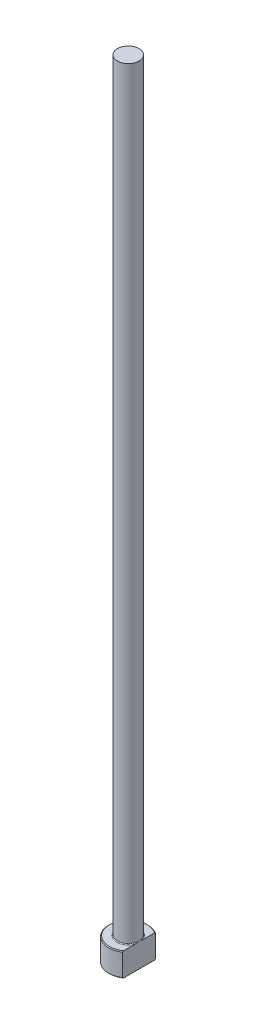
SolidWorks part; units mm, degrees
ref_plane "Front Plane" through (0, 0, 0) normal (0, 0, 1) x (1, 0, 0)
ref_plane "Top Plane" through (0, 0, 0) normal (0, 1, 0) x (1, 0, 0)
ref_plane "Right Plane" through (0, 0, 0) normal (1, 0, 0) x (0, 0, -1)
sketch "Sketch1" plane through (0, 0, 0) normal (0, 0, 1) x (1, 0, 0)
  line L0 (0, 259.9588) -> (0, -15.1925) construction
  line L1 (0, 0) -> (-5, 0)
  line L2 (-5, 0) -> (-5, 6)
  line L3 (-5, 6) -> (-2.75, 6)
  line L4 (-2.75, 6) -> (-2.75, 200)
  line L5 (-2.75, 200) -> (0, 200)
  line L6 (0, 200) -> (0, 0)
  dimension "L" = 200
  dimension "H" = 10
  dimension "T" = 6
  dimension "D" = 5.5
revolve "Revolve1" add sketch "Sketch1" angle 360 about L0
chamfer "Chamfer1" distance 0.2 angle 45 2 edges at (0, 6, 5) (0, 0, 5)
fillet "Fillet1" radius 0.2 1 edges at (0, 6, 2.75)
sketch "Sketch2" plane through (0, 0, 0) normal (0, 1, 0) x (1, 0, 0)
  line L0 (2.75, -4.1758) -> (2.75, 4.1758)
  circle A0 centre (0, 0) radius 5 construction
  arc A1 (2.75, -4.1758) -> (2.75, 4.1758) centre (0, 0) ccw
  circle A2 centre (0, 0) radius 2.75 construction
extrude "KEYED HEAD" cut sketch "Sketch2" along normal through all
